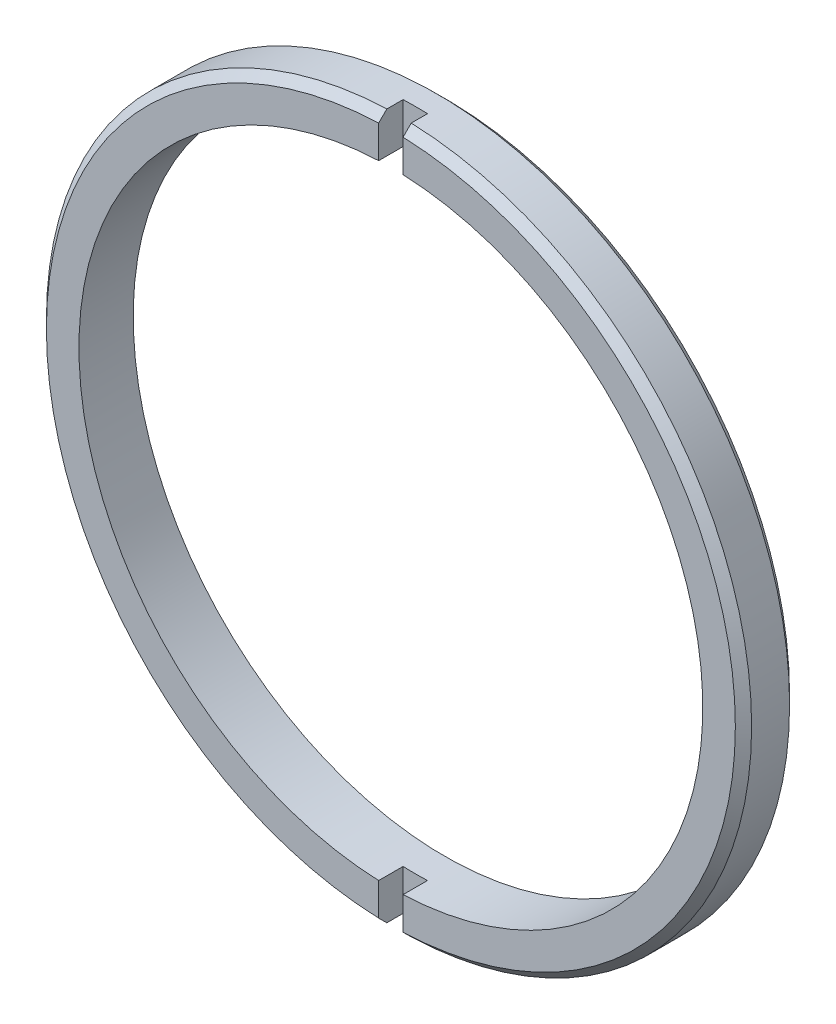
SolidWorks part; units mm, degrees
ref_plane "前视基准面" through (0, 0, 0) normal (0, 0, 1) x (1, 0, 0)
ref_plane "上视基准面" through (0, 0, 0) normal (0, 1, 0) x (1, 0, 0)
ref_plane "右视基准面" through (0, 0, 0) normal (1, 0, 0) x (0, 0, -1)
other "Configuration Table"
sketch "草图1" plane through (0, 0, 0) normal (0, 0, 1) x (1, 0, 0)
  circle A0 centre (0, 0) radius 11.5
  circle A1 centre (0, 0) radius 13
  dimension "D1" = 23
  dimension "D2" = 26
extrude "凸台-拉伸1" add sketch "草图1" along normal blind 2
sketch "草图2" plane through (0, 0, 0) normal (0, 1, 0) x (1, 0, 0)
  line L0 (-0.45, -2) -> (0.45, -2)
  line L1 (-13, -2) -> (13, -2) construction
  line L2 (0.45, -2) -> (0.45, -1.1)
  line L4 (0.45, -1.1) -> (-0.45, -1.1)
  line L5 (-0.45, -2) -> (-0.45, -1.1)
  point P10 (0, -1.1)
  dimension "D2" = 0.9
extrude "切除-拉伸1" cut sketch "草图2" against normal through all both and the other way through all
chamfer "倒角1" distance 0.3 angle 45 3 edges at (-13, 0, 2) (13, 0, 2) (13, 0, 0)
